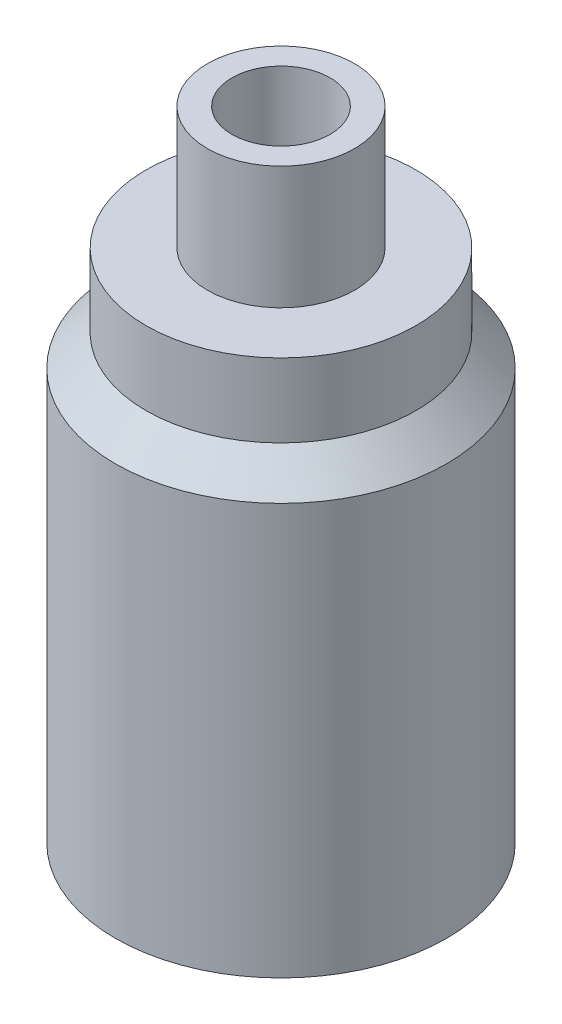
SolidWorks part; units mm, degrees
ref_plane "Přední rovina" through (0, 0, 0) normal (0, 0, 1) x (1, 0, 0)
ref_plane "Horní rovina" through (0, 0, 0) normal (0, 1, 0) x (1, 0, 0)
ref_plane "Pravá rovina" through (0, 0, 0) normal (1, 0, 0) x (0, 0, -1)
sketch "Skica1" plane through (0, 0, 0) normal (0, 1, 0) x (1, 0, 0)
  circle A0 centre (0, 0) radius 6.75
  dimension "D1" = 13.5
extrude "Přidat vysunutím1" add sketch "Skica1" along normal blind 26
sketch "Skica2" plane through (0, 26, 0) normal (0, 1, 0) x (1, 0, 0)
  circle A0 centre (0, 0) radius 3
  dimension "D1" = 6
extrude "Odebrat vysunutím1" cut sketch "Skica2" against normal blind 5 flip side to cut
sketch "Skica3" plane through (0, 21, 0) normal (0, 1, 0) x (1, 0, 0)
  circle A0 centre (0, 0) radius 5.5
  dimension "D1" = 11
extrude "Odebrat vysunutím2" cut sketch "Skica3" against normal blind 3 flip side to cut
chamfer "Zkosení1" distance 1.25 angle 45 1 edges at (0, 18, 6.75)
hole_wizard "Ø6.5 (6.5) průměr díry1" positions "Skica5" profile "Skica4" hole size "Ø6.5" standard "DIN"
sketch "Skica5" plane through (0, 0, 0) normal (0, -1, 0) x (1, 0, 0)
  circle A0 centre (0, 0) radius 6.75 construction
  point P0 (0, 0)
  dimension "D1" = 0
sketch "Skica4" plane through (0, 0, 0) normal (1, 0, 0) x (0, 0, -1)
  line L0 (0, 0) -> (0, 17.8764)
  line L1 (0, 17.8764) -> (3.25, 16)
  line L2 (3.25, 16) -> (3.25, 0)
  line L5 (3.25, 0) -> (0, 0)
  line L10 (0, 17.8764) -> (-3.25, 16) construction
  line L11 (0, -6.35) -> (0, 107.95) construction
  dimension "Průměr díry" = 6.5
  dimension "Hloubka díry" = 16
  dimension "Úhel vrtání" = 120
sketch "Skica6" plane through (0, 26, 0) normal (0, 1, 0) x (1, 0, 0)
  circle A0 centre (0, 0) radius 2
  dimension "D1" = 4
extrude "Odebrat vysunutím3" cut sketch "Skica6" against normal through all
